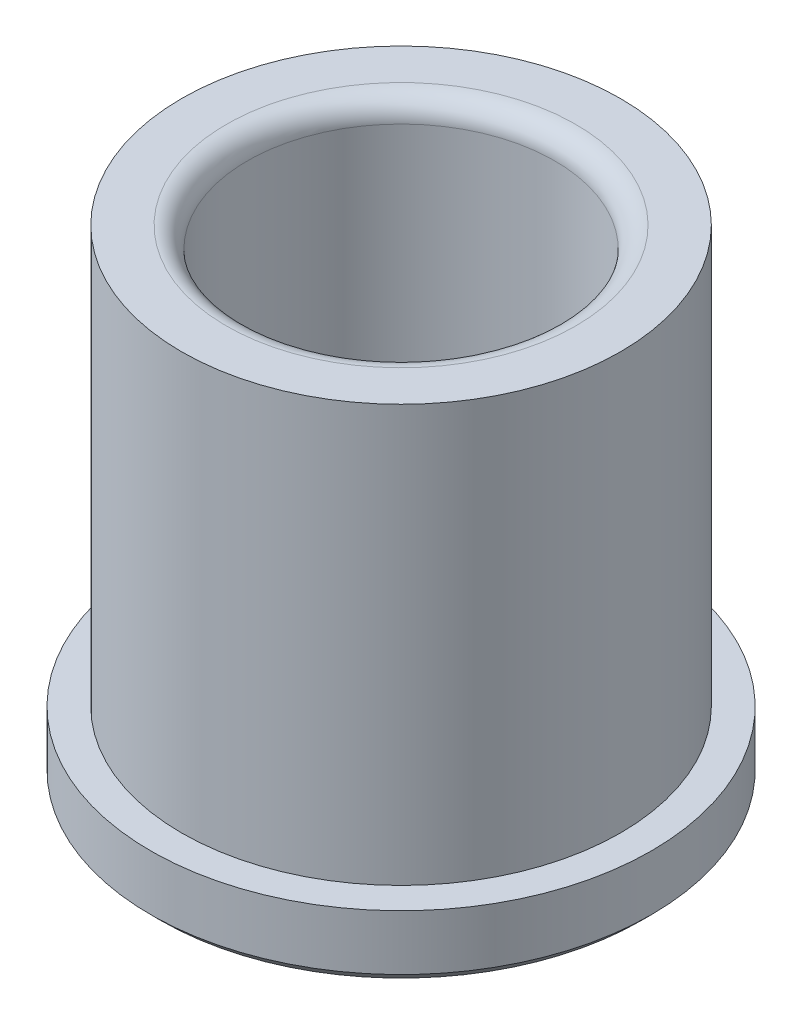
SolidWorks part; units mm, degrees
ref_plane "Front Plane" through (0, 0, 0) normal (0, 0, 1) x (1, 0, 0)
ref_plane "Top Plane" through (0, 0, 0) normal (0, 1, 0) x (1, 0, 0)
ref_plane "Right Plane" through (0, 0, 0) normal (1, 0, 0) x (0, 0, -1)
sketch "Sketch1" plane through (0, 0, 0) normal (0, 0, 1) x (1, 0, 0)
  line L0 (-17.3609, 0) -> (-18.1229, 0.762)
  line L1 (0, -1000) -> (0, 49000) construction
  line L2 (-11.1189, 34.925) -> (-11.1188, 0.762)
  line L3 (-11.8808, 0) -> (-17.3609, 0)
  line L4 (-18.1229, 0.762) -> (-18.1229, 4.7625)
  line L5 (-18.1229, 4.7625) -> (-15.8813, 4.7625)
  line L6 (-15.8813, 34.925) -> (-15.8813, 4.7625)
  line L7 (-15.8813, 34.925) -> (-11.1189, 34.925)
  line L8 (-11.8808, 0) -> (-11.1188, 0.762)
  dimension "OD" = 31.7627
  dimension "ID" = 22.2377
  dimension "H" = 36.2458
  dimension "D2" = 45
  dimension "OVERALL LENGTH" = 34.925
  dimension "D4" = 0.762
  dimension "D5" = 135
  dimension "T" = 4.7625
revolve "Revolve1" add sketch "Sketch1" angle 360 about L1
fillet "Fillet1" radius 1.524 1 edges at (11.1188, 34.925, 0)
